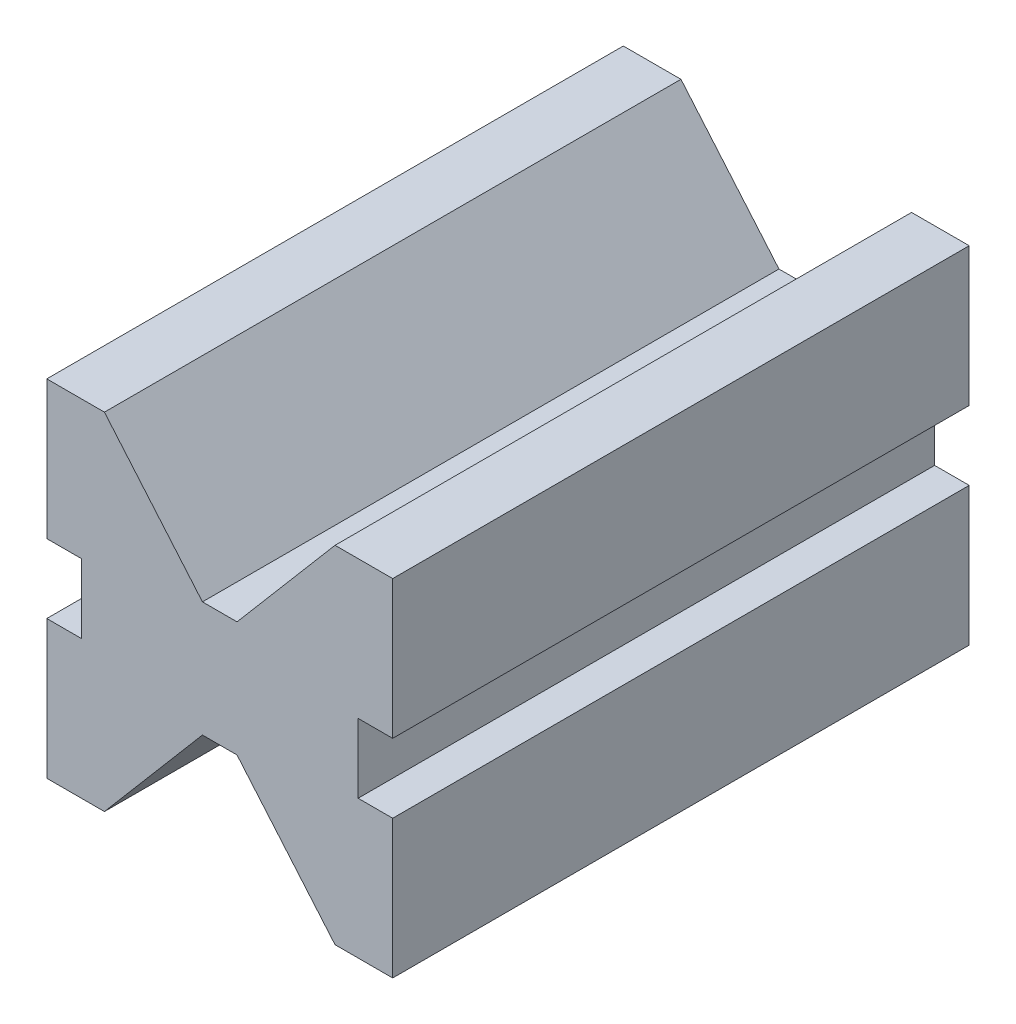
SolidWorks part; units mm, degrees
ref_plane "Front Plane" through (0, 0, 0) normal (0, 0, 1) x (1, 0, 0)
ref_plane "Top Plane" through (0, 0, 0) normal (0, 1, 0) x (1, 0, 0)
ref_plane "Right Plane" through (0, 0, 0) normal (1, 0, 0) x (0, 0, -1)
sketch "Sketch1" plane through (0, 0, 0) normal (0, 0, 1) x (1, 0, 0)
  line L0 (36.3757, 0) -> (0, 0) construction
  line L1 (0, 0) -> (0, 27.9488) construction
  line L2 (-3, -10) -> (3, -10)
  line L3 (3, -10) -> (20, -30)
  line L4 (20, -30) -> (30, -30)
  line L5 (30, -30) -> (30, -6)
  line L6 (30, -6) -> (24, -6)
  line L7 (24, -6) -> (24, 6)
  line L8 (24, 6) -> (30, 6)
  line L9 (30, 6) -> (30, 30)
  line L10 (30, 30) -> (20, 30)
  line L11 (20, 30) -> (3, 10)
  line L12 (3, 10) -> (-3, 10)
  line L13 (-3, 10) -> (-20, 30)
  line L14 (-20, 30) -> (-30, 30)
  line L15 (-30, 30) -> (-30, 6)
  line L16 (-30, 6) -> (-24, 6)
  line L17 (-24, 6) -> (-24, -6)
  line L18 (-24, -6) -> (-30, -6)
  line L19 (-30, -6) -> (-30, -30)
  line L20 (-30, -30) -> (-20, -30)
  line L21 (-20, -30) -> (-3, -10)
  dimension "D1" = 60
  dimension "D2" = 12
  dimension "D3" = 20
  dimension "D4" = 6
  dimension "D5" = 60
  dimension "D6" = 6
  dimension "D7" = 40
extrude "Boss-Extrude1" add sketch "Sketch1" along normal mid plane 100
